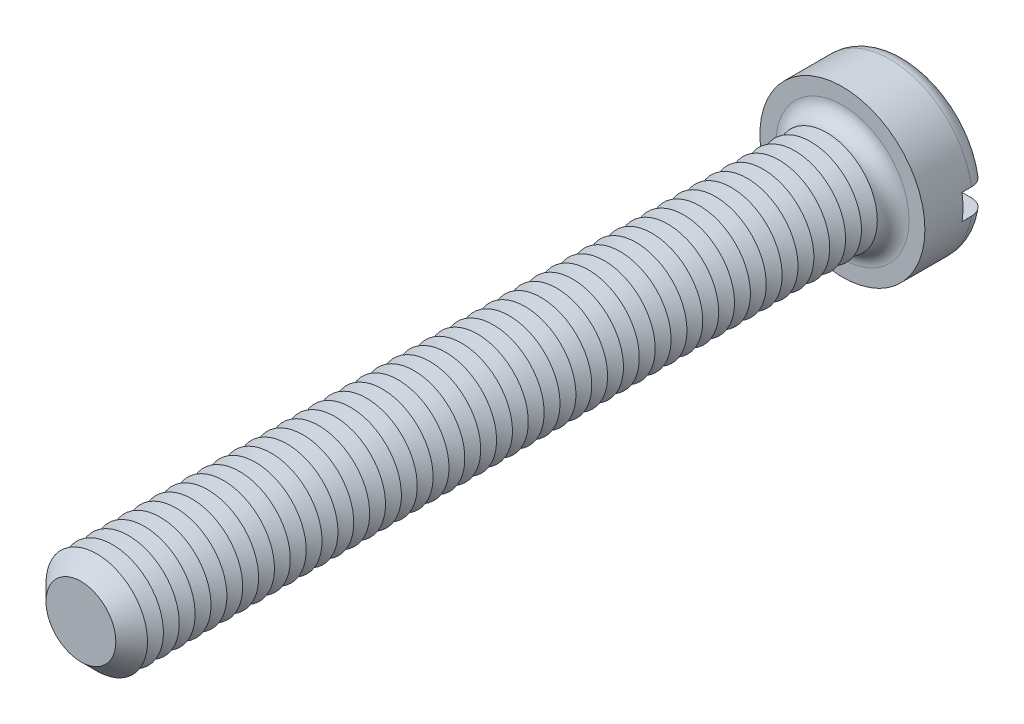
SolidWorks part; units mm, degrees
ref_plane "Front Plane" through (0, 0, 0) normal (0, 0, 1) x (1, 0, 0)
ref_plane "Top Plane" through (0, 0, 0) normal (0, 1, 0) x (1, 0, 0)
ref_plane "Right Plane" through (0, 0, 0) normal (1, 0, 0) x (0, 0, -1)
sketch "Sketch3" plane through (0, 0, 0) normal (0, 0, 1) x (1, 0, 0)
  circle A0 centre (0, 0) radius 6.5
  dimension "D1" = 13
extrude "Boss-Extrude2" add sketch "Sketch3" against normal blind 5
sketch "Sketch4" plane through (0, 0, 0) normal (0, 0, 1) x (1, 0, 0)
  circle A0 centre (0, 0) radius 4
  dimension "D1" = 8
extrude "Boss-Extrude3" add sketch "Sketch4" along normal blind 60
fillet "Fillet1" radius 1.25 2 edges at (6.5, 0, -5) (4, 0, 0)
chamfer "Chamfer1" distance 1.25 angle 45 1 edges at (4, 0, 60)
sketch "Sketch5" plane through (0, 0, 0) normal (1, 0, 0) x (0, 0, -1)
  line L0 (1.6944, 0) -> (-7.6738, 0) construction
sketch "Sketch6" plane through (0, 0, 0) normal (1, 0, 0) x (0, 0, -1)
  line L0 (-1.25, 4) -> (-1.875, 2.9175)
  line L1 (-1.875, 2.9175) -> (-2.5, 4)
  line L2 (-1.25, 4) -> (-58.75, 4) construction
  line L3 (-2.5, 4) -> (-1.25, 4)
  dimension "D1" = 1.25
revolve "Cut-Revolve1" cut sketch "Sketch6" angle 360 about L0
pattern_linear "LPattern1" count 46 spacing 1.25 along (0, 0, 1) of "Cut-Revolve1"
sketch "Sketch8" plane through (0, 0, -5) normal (0, 0, -1) x (-1, 0, 0)
  line L1 (6.5, -1) -> (-6.5, -1)
  line L2 (6.5, -1) -> (6.5, 1)
  line L3 (6.5, 1) -> (-6.5, 1)
  line L4 (-6.5, -1) -> (-6.5, 1)
  line L5 (6.5, -1) -> (-6.5, 1) construction
  line L6 (6.5, 1) -> (-6.5, -1) construction
  point P0 (0, 0)
  dimension "D1" = 13
  dimension "D2" = 2
extrude "Cut-Extrude1" cut sketch "Sketch8" against normal blind 2
